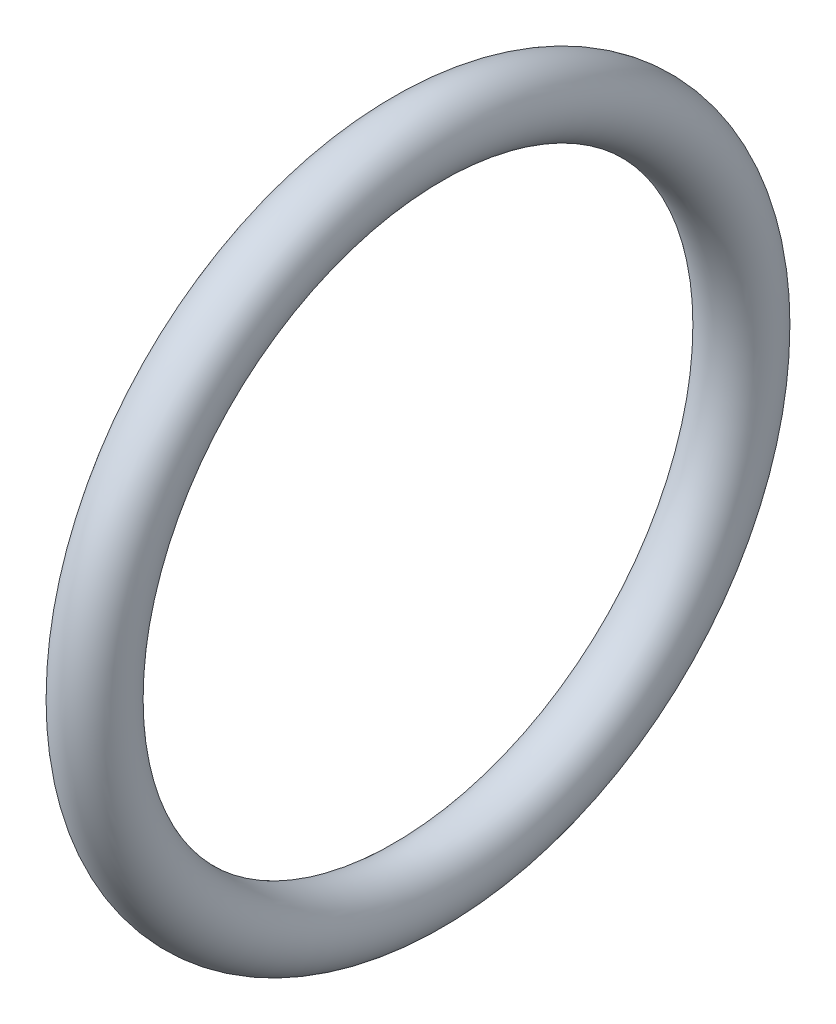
SolidWorks part; units mm, degrees
ref_plane "Plan de face" through (0, 0, 0) normal (0, 0, 1) x (1, 0, 0)
ref_plane "Plan de dessus" through (0, 0, 0) normal (0, 1, 0) x (1, 0, 0)
ref_plane "Plan de droite" through (0, 0, 0) normal (1, 0, 0) x (0, 0, -1)
sketch "Esquisse1" plane through (0, 0, 0) normal (0, 1, 0) x (1, 0, 0)
  line L0 (-46.2323, 0) -> (44.976, 0) construction
  circle A0 centre (-0.6282, 8.95) radius 0.95
  dimension "D1" = 8.95
revolve "Révolution1" add sketch "Esquisse1" angle 360 about L0
